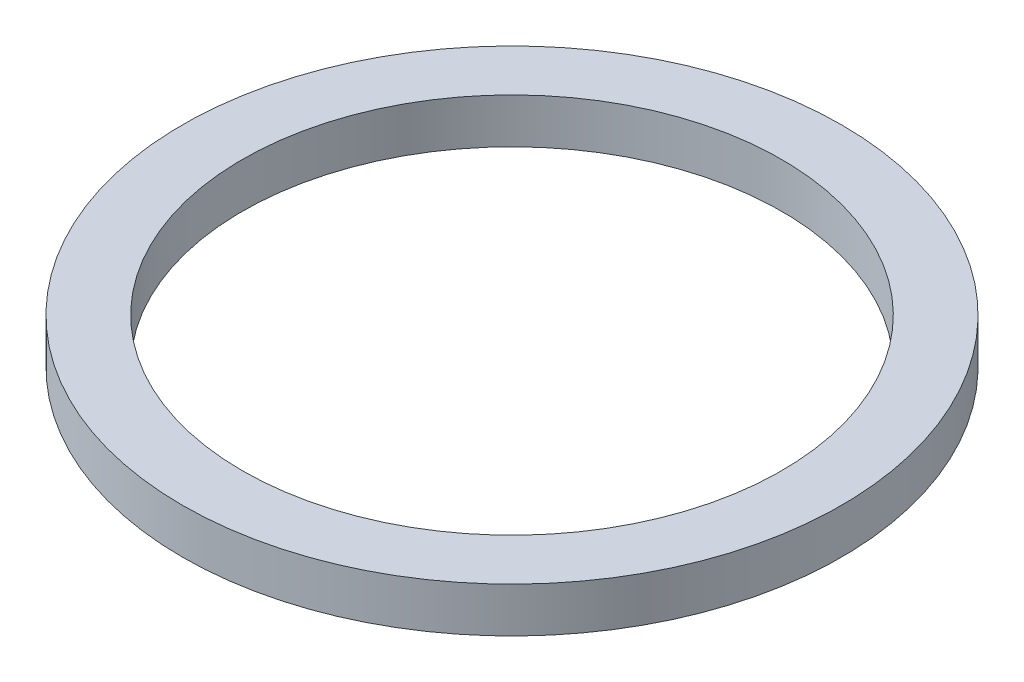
SolidWorks part; units mm, degrees
ref_plane "Front Plane" through (0, 0, 0) normal (0, 0, 1) x (1, 0, 0)
ref_plane "Top Plane" through (0, 0, 0) normal (0, 1, 0) x (1, 0, 0)
ref_plane "Right Plane" through (0, 0, 0) normal (1, 0, 0) x (0, 0, -1)
sketch "Sketch1" plane through (0, 0, 0) normal (0, 1, 0) x (1, 0, 0)
  circle A0 centre (0, 0) radius 11000
  circle A1 centre (0, 0) radius 9000
extrude "Boss-Extrude1" add sketch "Sketch1" along normal blind 1500
sketch "Sketch2" plane through (0, 0, 0) normal (0, 1, 0) x (1, 0, 0)
  line L0 (12000, -8000) -> (95000, -8000)
  line L1 (95000, -8000) -> (95000, 8000)
  line L2 (95000, 8000) -> (12000, 8000)
  line L3 (12000, 8000) -> (12000, -8000)
  line L4 (12928.2032, 6392.3048) -> (54428.2032, 78272.4134)
  line L5 (54428.2032, 78272.4134) -> (40571.7968, 86272.4134)
  line L6 (40571.7968, 86272.4134) -> (-928.2032, 14392.3048)
  line L7 (-928.2032, 14392.3048) -> (12928.2032, 6392.3048)
  line L8 (928.2032, 14392.3048) -> (-40571.7968, 86272.4134)
  line L9 (-40571.7968, 86272.4134) -> (-54428.2032, 78272.4134)
  line L10 (-54428.2032, 78272.4134) -> (-12928.2032, 6392.3048)
  line L11 (-12928.2032, 6392.3048) -> (928.2032, 14392.3048)
  line L12 (-12000, 8000) -> (-95000, 8000)
  line L13 (-95000, 8000) -> (-95000, -8000)
  line L14 (-95000, -8000) -> (-12000, -8000)
  line L15 (-12000, -8000) -> (-12000, 8000)
  line L16 (-12928.2032, -6392.3048) -> (-54428.2032, -78272.4134)
  line L17 (-54428.2032, -78272.4134) -> (-40571.7968, -86272.4134)
  line L18 (-40571.7968, -86272.4134) -> (928.2032, -14392.3048)
  line L19 (928.2032, -14392.3048) -> (-12928.2032, -6392.3048)
  line L20 (-928.2032, -14392.3048) -> (40571.7968, -86272.4134)
  line L21 (40571.7968, -86272.4134) -> (54428.2032, -78272.4134)
  line L22 (54428.2032, -78272.4134) -> (12928.2032, -6392.3048)
  line L23 (12928.2032, -6392.3048) -> (-928.2032, -14392.3048)
sketch "Sketch3" plane through (0, 0, 0) normal (0, 1, 0) x (1, 0, 0)
  line L0 (10853.7066, -1788.0305) -> (95000, -900)
  line L1 (95000, -8000) -> (95000, 8000) construction
  line L2 (95000, -900) -> (95000, 900)
  line L3 (95000, 900) -> (10963.12, 900)
  line L4 (10963.12, 900) -> (10963.12, -900)
  line L5 (6975.3332, 8505.5704) -> (48279.4229, 81822.4134)
  line L6 (54428.2032, 78272.4134) -> (40571.7968, 86272.4134) construction
  line L7 (48279.4229, 81822.4134) -> (46720.5771, 82722.4134)
  line L8 (46720.5771, 82722.4134) -> (4702.1371, 9944.3404)
  line L9 (4702.1371, 9944.3404) -> (6260.9829, 9044.3404)
  line L10 (-4702.1371, 9944.3404) -> (-46720.5771, 82722.4134)
  line L11 (-40571.7968, 86272.4134) -> (-54428.2032, 78272.4134) construction
  line L12 (-46720.5771, 82722.4134) -> (-48279.4229, 81822.4134)
  line L13 (-48279.4229, 81822.4134) -> (-6260.9829, 9044.3404)
  line L14 (-6260.9829, 9044.3404) -> (-4702.1371, 9944.3404)
  line L15 (-10963.12, 900) -> (-95000, 900)
  line L16 (-95000, 8000) -> (-95000, -8000) construction
  line L17 (-95000, 900) -> (-95000, -900)
  line L18 (-95000, -900) -> (-10963.12, -900)
  line L19 (-10963.12, -900) -> (-10963.12, 900)
  line L20 (-6260.9829, -9044.3404) -> (-48279.4229, -81822.4134)
  line L21 (-54428.2032, -78272.4134) -> (-40571.7968, -86272.4134) construction
  line L22 (-48279.4229, -81822.4134) -> (-46720.5771, -82722.4134)
  line L23 (-46720.5771, -82722.4134) -> (-4702.1371, -9944.3404)
  line L24 (-4702.1371, -9944.3404) -> (-6260.9829, -9044.3404)
  line L25 (4702.1371, -9944.3404) -> (46720.5771, -82722.4134)
  line L26 (40571.7968, -86272.4134) -> (54428.2032, -78272.4134) construction
  line L27 (46720.5771, -82722.4134) -> (48279.4229, -81822.4134)
  line L28 (48279.4229, -81822.4134) -> (6260.9829, -9044.3404)
  line L29 (6260.9829, -9044.3404) -> (4702.1371, -9944.3404)
  circle A0 centre (0, 0) radius 11000 construction
